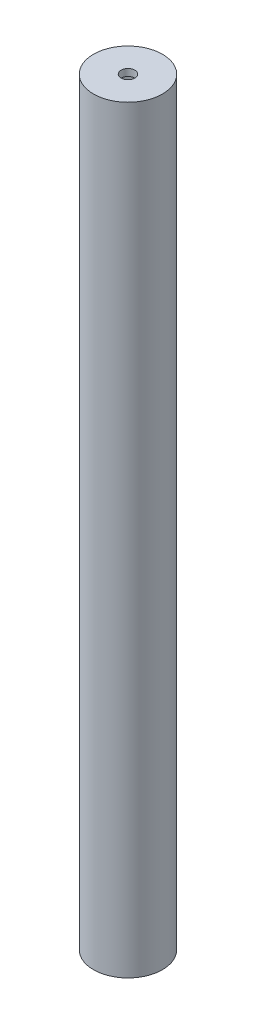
SolidWorks part; units mm, degrees
ref_plane "Front Plane" through (0, 0, 0) normal (0, 0, 1) x (1, 0, 0)
ref_plane "Top Plane" through (0, 0, 0) normal (0, 1, 0) x (1, 0, 0)
ref_plane "Right Plane" through (0, 0, 0) normal (1, 0, 0) x (0, 0, -1)
sketch "Sketch1" plane through (0, 0, 0) normal (0, 0, 1) x (1, 0, 0)
  line L0 (-51.2668, 355.4921) -> (-66.2668, 355.4921)
  line L1 (-66.2668, 355.4921) -> (-66.2668, -194.5079)
  line L2 (-66.2668, -194.5079) -> (-51.2668, -194.5079)
  line L5 (-51.2668, 350.4921) -> (-61.2668, 350.4921)
  line L6 (-61.2668, 350.4921) -> (-61.2668, -189.5079)
  line L7 (-61.2668, -189.5079) -> (-51.2668, -189.5079)
  line L8 (-41.2668, 300.4921) -> (-41.2668, -189.5079) construction
  line L9 (0, 355.4921) -> (-66.2668, 355.4921) construction
  line L10 (-5, 350.4921) -> (-61.2668, 350.4921) construction
  line L11 (-5, -189.5079) -> (-5, 350.4921) construction
  line L12 (0, -194.5079) -> (0, 355.4921) construction
  line L13 (-61.2668, -189.5079) -> (-5, -189.5079) construction
  line L14 (-66.2668, -194.5079) -> (0, -194.5079) construction
  line L17 (-51.2668, -189.5079) -> (-51.2668, -194.5079)
  line L19 (-51.2668, 355.4921) -> (-46.2668, 355.4921)
  line L20 (-46.2668, 360.4921) -> (-46.2668, 355.1758) construction
  line L21 (-46.2668, 355.4921) -> (-46.2652, 350.4921)
  line L22 (-46.2652, 350.4921) -> (-51.2668, 350.4921)
  dimension "D2" = 40
  dimension "D3" = 550
  dimension "D4" = 10
  dimension "D1" = 5
revolve "Revolve1" add sketch "Sketch1" angle 360 about L8
